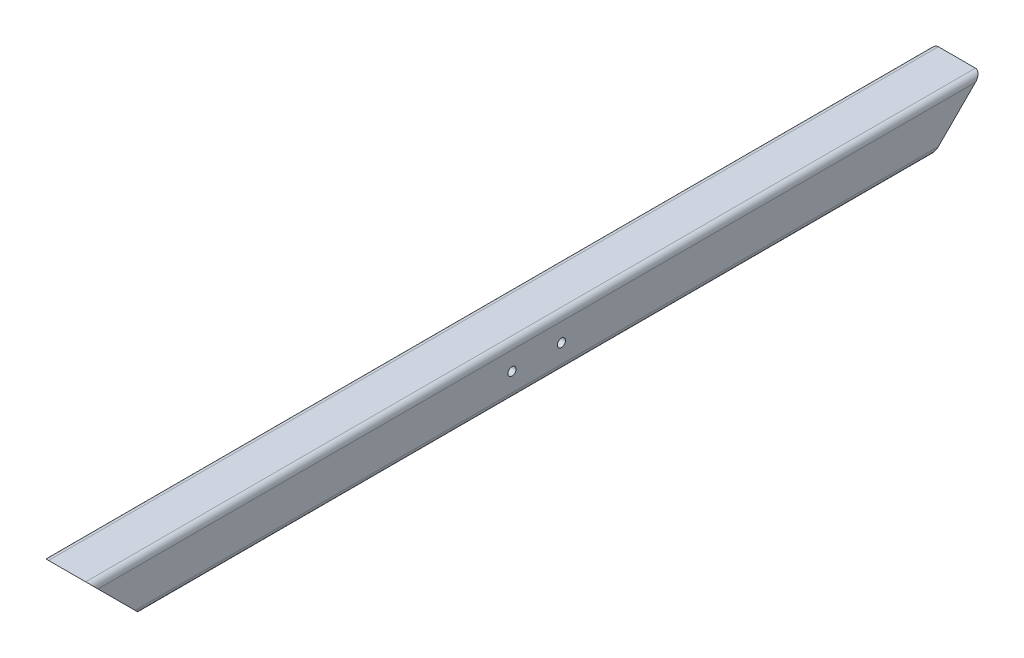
SolidWorks part; units mm, degrees
ref_plane "Front Plane" through (0, 0, 0) normal (0, 0, 1) x (1, 0, 0)
ref_plane "Top Plane" through (0, 0, 0) normal (0, 1, 0) x (1, 0, 0)
ref_plane "Right Plane" through (0, 0, 0) normal (1, 0, 0) x (0, 0, -1)
sketch "Sketch1" plane through (0, 0, 0) normal (0, 0, 1) x (1, 0, 0)
  line L0 (-19.05, -19.05) -> (-19.05, 19.05)
  line L1 (-19.05, -25.4) -> (19.05, -25.4)
  line L2 (-25.4, -19.05) -> (-25.4, 19.05)
  line L3 (-19.05, 25.4) -> (19.05, 25.4)
  line L4 (25.4, -19.05) -> (25.4, 19.05)
  line L5 (-19.05, 19.05) -> (19.05, 19.05)
  line L6 (19.05, -19.05) -> (19.05, 19.05)
  line L7 (-19.05, -19.05) -> (19.05, -19.05)
  arc A0 (-19.05, -25.4) -> (-25.4, -19.05) centre (-19.05, -19.05) cw
  arc A1 (19.05, -25.4) -> (25.4, -19.05) centre (19.05, -19.05) ccw
  arc A2 (19.05, 25.4) -> (25.4, 19.05) centre (19.05, 19.05) cw
  arc A3 (-25.4, 19.05) -> (-19.05, 25.4) centre (-19.05, 19.05) cw
  arc A4 (-19.05, 19.05) -> (-19.05, 19.05) centre (-19.05, 19.05) cw
  arc A5 (19.05, 19.05) -> (19.05, 19.05) centre (19.05, 19.05) cw
  arc A6 (19.05, -19.05) -> (19.05, -19.05) centre (19.05, -19.05) ccw
  arc A7 (-19.05, -19.05) -> (-19.05, -19.05) centre (-19.05, -19.05) cw
  dimension "D5" = 6.35
  dimension "D1" = 50.8
  dimension "D2" = 50.8
  dimension "D3" = 25.4
  dimension "D4" = 25.4
  dimension "D6" = 6.35
extrude "Boss-Extrude1" add sketch "Sketch1" against normal blind 914.4
sketch "Sketch2" plane through (25.4, 0, 0) normal (1, 0, 0) x (0, 0, -1)
  line L0 (0, 25.4) -> (50.8, -25.4)
  line L1 (914.4, -25.4) -> (0, -25.4) construction
  line L2 (0, -19.05) -> (0, 19.05) construction
  dimension "D1" = 45
extrude "Cut-Extrude1" cut sketch "Sketch2" against normal through all and the other way through all flip side to cut
sketch "Sketch3" plane through (25.4, 0, 0) normal (1, 0, 0) x (0, 0, -1)
  line L0 (914.4, 25.4) -> (863.6, -25.4)
  line L1 (914.4, -25.4) -> (50.8, -25.4) construction
  line L2 (914.4, -19.05) -> (914.4, 19.05) construction
  dimension "D1" = 45
extrude "Cut-Extrude2" cut sketch "Sketch3" against normal through all and the other way through all
sketch "Sketch4" plane through (25.4, 0, 0) normal (1, 0, 0) x (0, 0, -1)
  circle A0 centre (50.8, 0) radius 3.3655
  circle A1 centre (101.6, 0) radius 3.3655
  circle A2 centre (152.4, 0) radius 3.3655
  circle A3 centre (203.2, 0) radius 3.3655
  circle A4 centre (254, 0) radius 3.3655
  circle A5 centre (304.8, 0) radius 3.3655
  circle A6 centre (355.6, 0) radius 3.3655
  circle A7 centre (406.4, 0) radius 3.3655
  circle A8 centre (457.2, 0) radius 3.3655
  circle A9 centre (508, 0) radius 3.3655
  circle A10 centre (558.8, 0) radius 3.3655
  circle A11 centre (609.6, 0) radius 3.3655
  circle A12 centre (660.4, 0) radius 3.3655
  circle A13 centre (711.2, 0) radius 3.3655
  circle A14 centre (762, 0) radius 3.3655
  circle A15 centre (812.8, 0) radius 3.3655
  circle A16 centre (863.6, 0) radius 3.3655
  dimension "D13" = 6.731
  dimension "D14" = 6.731
  dimension "D15" = 6.731
  dimension "D16" = 6.731
  dimension "D17" = 6.731
  dimension "D18" = 6.731
  dimension "D19" = 6.731
  dimension "D20" = 6.731
  dimension "D21" = 6.731
  dimension "D22" = 6.731
  dimension "D23" = 6.731
  dimension "D24" = 6.731
  dimension "D29" = 50.8
  dimension "D30" = 6.731
  dimension "D31" = 6.731
  dimension "D32" = 6.731
  dimension "D33" = 6.731
  dimension "D34" = 6.731
  dimension "D1" = 50.8
  dimension "D2" = 50.8
  dimension "D3" = 50.8
  dimension "D4" = 50.8
  dimension "D5" = 50.8
  dimension "D6" = 50.8
  dimension "D7" = 50.8
  dimension "D8" = 50.8
  dimension "D9" = 50.8
  dimension "D10" = 50.8
  dimension "D11" = 50.8
  dimension "D12" = 50.8
  dimension "D25" = 50.8
  dimension "D26" = 50.8
  dimension "D27" = 50.8
  dimension "D28" = 50.8
extrude "Cut-Extrude3" [suppressed] cut sketch "Sketch4" against normal blind 660.4
hole_wizard "5/16 Clearance Hole1" positions "Sketch8" profile "Sketch7" hole size "5/16" standard "ANSI Inch"
sketch "Sketch8" plane through (25.4, 0, 0) normal (1, 0, 0) x (0, 0, -1)
  line L0 (25.4, 0) -> (889, 0) construction
  line L1 (44.45, -19.05) -> (6.35, 19.05) construction
  line L2 (869.95, -19.05) -> (908.05, 19.05) construction
  line L3 (457.2, 0) -> (457.2, 83.2936) construction
  point P0 (482.6, 0)
  point P13 (431.8, 0)
  dimension "D1" = 50.8
sketch "Sketch7" plane through (25.4, 0, -482.6) normal (0, 1, 0) x (0, 0, -1)
  line L0 (0, 0) -> (0, 50.8)
  line L1 (0, 50.8) -> (4.2164, 50.8)
  line L2 (4.2164, 50.8) -> (4.2164, 0)
  line L5 (4.2164, 0) -> (0, 0)
  line L11 (0, -6.35) -> (0, 107.95) construction
  dimension "Thru Hole Dia." = 8.4328
  dimension "Thru Hole Depth" = 50.8
